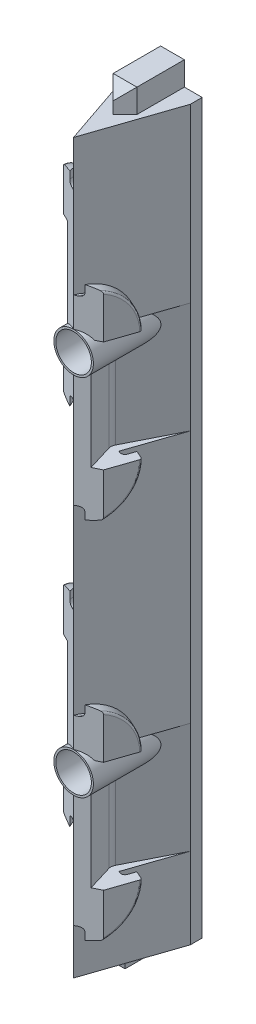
SolidWorks part; units mm, degrees
ref_plane "Plan de face" through (0, 0, 0) normal (0, 0, 1) x (1, 0, 0)
ref_plane "Plan de dessus" through (0, 0, 0) normal (0, 1, 0) x (1, 0, 0)
ref_plane "Plan de droite" through (0, 0, 0) normal (1, 0, 0) x (0, 0, -1)
body saved out of another part "Stock-hautBarette-1"
sketch "Esquisse1" plane through (0, 0, -3) normal (0, 0, -1) x (-1, 0, 0)
  line L0 (7.5, -119.9983) -> (22.5, -119.9983) construction
  line L1 (12, -119.9983) -> (18, -119.9983)
  line L2 (12, -119.9983) -> (12, -113.9983)
  line L3 (12, -113.9983) -> (18, -113.9983)
  line L4 (18, -119.9983) -> (18, -113.9983)
  line L5 (7.5, -119.9983) -> (7.5, -303.9983) construction
  line L6 (7.5, -303.9983) -> (22.5, -303.9983) construction
  line L7 (13.5, -303.9983) -> (16.5, -303.9983)
  line L8 (13.5, -303.9983) -> (13.5, -306.9983)
  line L9 (13.5, -306.9983) -> (16.5, -306.9983)
  line L10 (16.5, -303.9983) -> (16.5, -306.9983)
  line L11 (22.5, -119.9983) -> (22.5, -303.9983) construction
  point P8 (15, -113.9983)
  point P15 (15, -306.9983)
  dimension "D1" = 6
  dimension "D2" = 6
  dimension "D3" = 7.5
  dimension "D4" = 3
  dimension "D5" = 3
  dimension "D6" = 7.5
extrude "Boss.-Extru.1" add sketch "Esquisse1" against normal blind 15
chamfer "Chanfrein1" distance 3 angle 45 3 edges at (-18, -116.9983, 12) (-15, -113.9983, 12) (-12, -116.9983, 12)
chamfer "Chanfrein2" distance 1.5 angle 45 3 edges at (-13.5, -305.4983, 12) (-16.5, -305.4983, 12) (-15, -306.9983, 12)
sketch "Esquisse2" plane through (0, 0, -3) normal (0, 0, -1) x (-1, 0, 0)
  line B0 (17.0391, -131.053) -> (17.0391, -159.4851) construction
  line B1 (17.0391, -175.4926) -> (17.0391, -246.4417) construction
sketch_block_instance "Bloc1-1"
sketch_block "Bloc1"
extrude "Enlèv. mat.-Extru.1" cut sketch "Esquisse2" against normal blind 1.5
